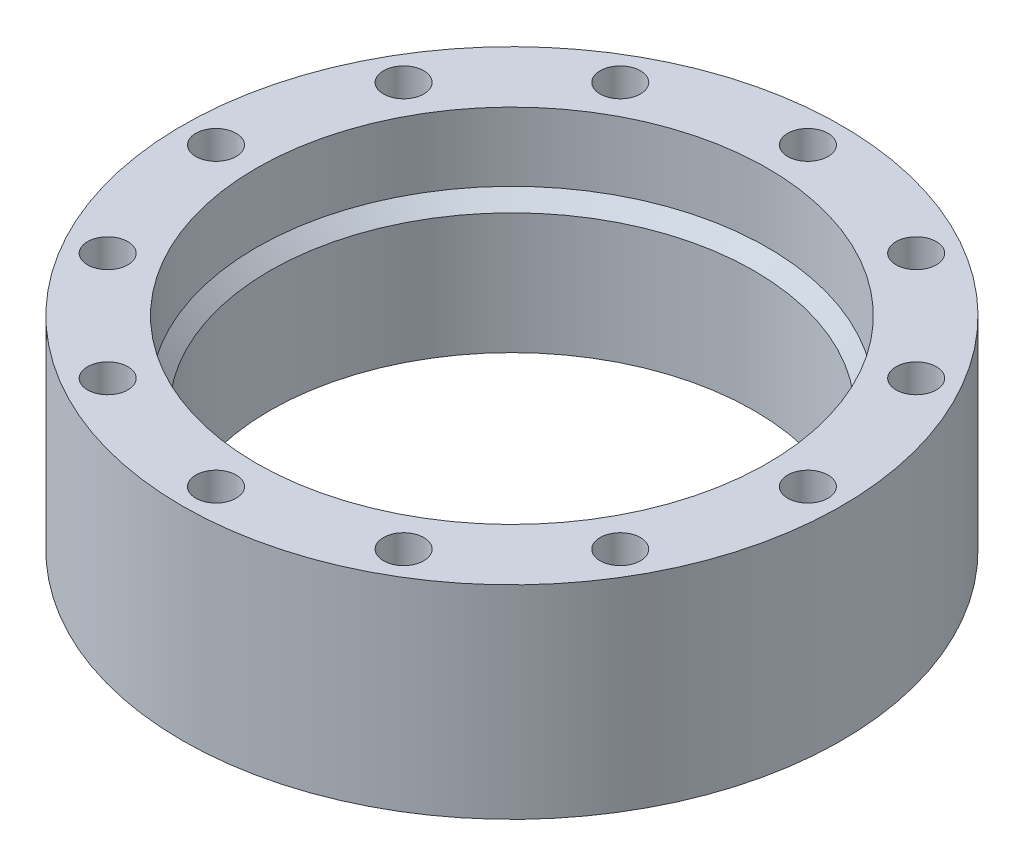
SolidWorks part; units mm, degrees
ref_plane "Alzado" through (0, 0, 0) normal (0, 0, 1) x (1, 0, 0)
ref_plane "Planta" through (0, 0, 0) normal (0, 1, 0) x (1, 0, 0)
ref_plane "Vista lateral" through (0, 0, 0) normal (1, 0, 0) x (0, 0, -1)
sketch "Sketch1" plane through (0, 0, 0) normal (0, 1, 0) x (1, 0, 0)
  circle A0 centre (0, 0) radius 24.5
  circle A1 centre (0, 0) radius 19
  dimension "D1" = 38
  dimension "D2" = 49
extrude "Boss-Extrude1" add sketch "Sketch1" along normal blind 15.1
sketch "Sketch2" plane through (0, 15.1, 0) normal (0, 1, 0) x (1, 0, 0)
  line L0 (0, 22) -> (0, 0) construction
  circle A0 centre (0, 22) radius 1.5
  circle A1 centre (11, 19.0526) radius 1.5
  circle A2 centre (19.0526, 11) radius 1.5
  circle A3 centre (22, 0) radius 1.5
  circle A4 centre (19.0526, -11) radius 1.5
  circle A5 centre (11, -19.0526) radius 1.5
  circle A6 centre (0, -22) radius 1.5
  circle A7 centre (-11, -19.0526) radius 1.5
  circle A8 centre (-19.0526, -11) radius 1.5
  circle A9 centre (-22, 0) radius 1.5
  circle A10 centre (-19.0526, 11) radius 1.5
  circle A11 centre (-11, 19.0526) radius 1.5
  dimension "D1" = 3
  dimension "D2" = 22
  dimension "D3" = 12
extrude "Cut-Extrude1" cut sketch "Sketch2" against normal blind 5
sketch "Sketch3" plane through (0, 0, 0) normal (0, 0, 1) x (1, 0, 0)
  line L0 (18, 0) -> (18, 9)
  line L1 (-24.5, 0) -> (24.5, 0) construction
  line L2 (18, 9) -> (19, 10)
  line L3 (19, 10) -> (19, 0)
  line L4 (19, 0) -> (18, 0)
  line L6 (0, 0) -> (0, 15.1) construction
  line L7 (1.5, 15.1) -> (-1.5, 15.1) construction
  dimension "D1" = 45
  dimension "D2" = 19
  dimension "D3" = 9
  dimension "D4" = 18
revolve "Revolve1" add sketch "Sketch3" angle 360 about L6
